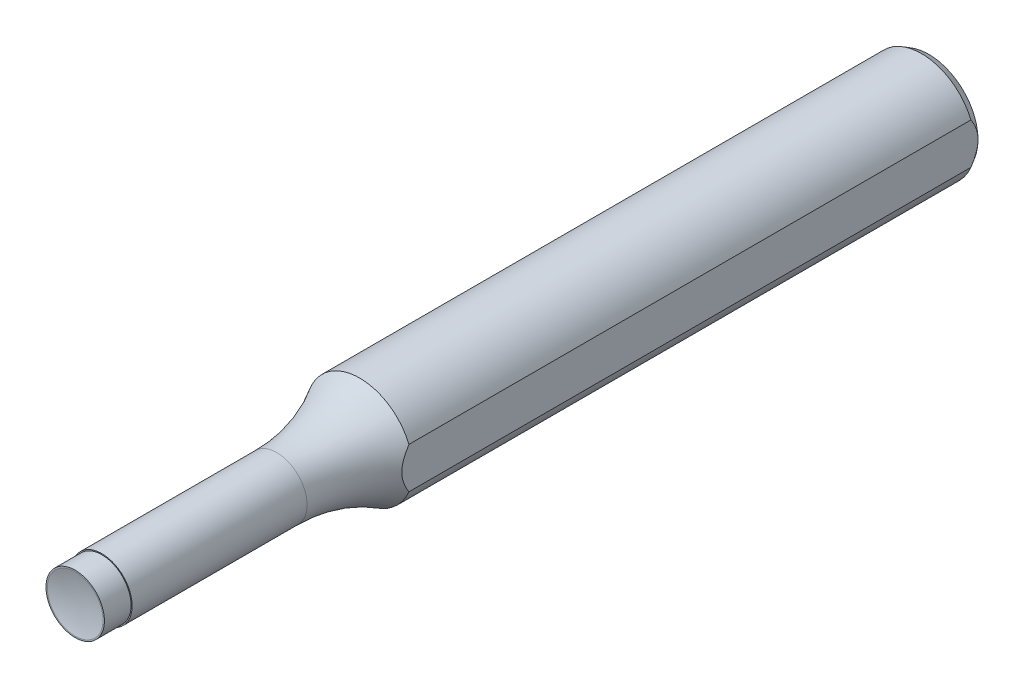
SolidWorks part; units mm, degrees
ref_plane "Front Plane" through (0, 0, 0) normal (0, 0, 1) x (1, 0, 0)
ref_plane "Top Plane" through (0, 0, 0) normal (0, 1, 0) x (1, 0, 0)
ref_plane "Right Plane" through (0, 0, 0) normal (1, 0, 0) x (0, 0, -1)
sketch "Sketch1" plane through (0, 0, 0) normal (0, 0, 1) x (1, 0, 0)
  circle A0 centre (0, 0) radius 7.94
  dimension "D1" = 15.88
extrude "Boss-Extrude1" add sketch "Sketch1" against normal blind 127
sketch "Sketch2" plane through (0, 0, 0) normal (0, 0, 1) x (1, 0, 0)
  circle A0 centre (0, 0) radius 4.5
  dimension "D1" = 9
extrude "Cut-Extrude1" cut sketch "Sketch2" against normal blind 42.3333 flip side to cut
sketch "Sketch3" plane through (0, 0, 0) normal (0, 0, 1) x (1, 0, 0)
  circle A0 centre (0, 0) radius 4.35
  dimension "D1" = 8.7
extrude "Cut-Extrude2" cut sketch "Sketch3" against normal blind 3.97 flip side to cut
sketch "Sketch4" plane through (0, 0, 0) normal (1, 0, 0) x (0, 0, -1)
  line L0 (0, 0) -> (0, 4.15)
  line L1 (0, 4.35) -> (0, -4.35) construction
  line L2 (0.5519, 0) -> (0.5519, 4.15) construction
  line L3 (0, 0) -> (0.5519, 0)
  line L4 (0, 0) -> (0, -4.15) construction
  arc A0 (0.5519, 0) -> (0, 4.15) centre (-15.3281, 0) ccw
  dimension "D2" = 15.88
  dimension "D1" = 8.3
revolve "Cut-Revolve1" cut sketch "Sketch4" angle 360 about L3
chamfer "Chamfer1" distance 1.0587 angle 30 1 edges at (7.94, 0, -127)
sketch "Sketch5" plane through (0, 0, 0) normal (1, 0, 0) x (0, 0, -1)
  line L0 (42.3333, 0) -> (30.0026, 0)
  line L1 (42.3333, 7.94) -> (42.3333, -7.94) construction
  line L2 (30.0026, 0) -> (30.0026, 4.5)
  line L3 (42.3333, 4.5) -> (3.97, 4.5) construction
  line L4 (42.3333, 7.94) -> (42.3333, 0)
  line L5 (30.0026, 4.5) -> (42.3333, 4.5) construction
  arc A0 (30.0026, 4.5) -> (42.3333, 7.94) centre (30.0026, 28.32) ccw
  dimension "D1" = 23.82
revolve "Revolve1" add sketch "Sketch5" angle 360 about L0
sketch "Sketch6" plane through (0, 0, 0) normal (1, 0, 0) x (0, 0, -1)
  line L0 (84.6667, 0) -> (108.4867, 0)
  line L1 (84.6667, 0) -> (84.6667, 15.88)
  line L2 (84.6667, 15.88) -> (94.7342, 15.88)
  line L3 (108.4867, 0) -> (108.4867, 7.94)
  line L4 (125.9413, 7.94) -> (42.3333, 7.94) construction
  line L5 (108.4867, 7.94) -> (84.6667, 7.94) construction
  line L6 (127, -7.94) -> (127, 7.94) construction
  arc A0 (108.4867, 7.94) -> (94.7342, 15.88) centre (108.4867, 23.82) cw
  dimension "D2" = 15.88
  dimension "D1" = 42.3333
  dimension "D3" = 23.82
revolve "Revolve2" [suppressed] add sketch "Sketch6" angle 360 about L0
sketch "Sketch7" plane through (0, 0, -127) normal (0, 0, -1) x (-1, 0, 0)
  line L9 (-13.4386, 3.0549) -> (-7.3288, 3.0549)
  line L10 (-13.4386, 3.0549) -> (-13.4386, -3.0549)
  line L11 (-13.4386, -3.0549) -> (-7.3288, -3.0549)
  line L12 (-7.3288, 3.0549) -> (-7.3288, -3.0549)
  circle A5 centre (0, 0) radius 7.94 construction
  circle A6 centre (0, 0) radius 7.3288 construction
  point P8 (-7.3288, 0)
extrude "Cut-Extrude3" cut sketch "Sketch7" against normal through all
